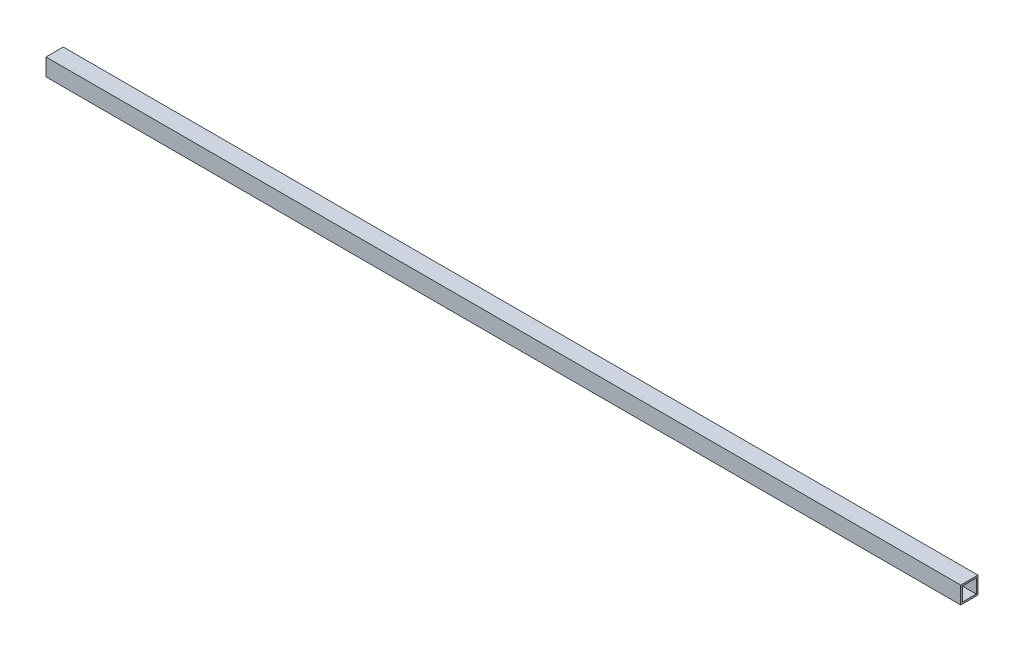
SolidWorks part; units mm, degrees
ref_plane "Plan de face" through (0, 0, 0) normal (0, 0, 1) x (1, 0, 0)
ref_plane "Plan de dessus" through (0, 0, 0) normal (0, 1, 0) x (1, 0, 0)
ref_plane "Plan de droite" through (0, 0, 0) normal (1, 0, 0) x (0, 0, -1)
sketch "Esquisse1" plane through (0, 0, 0) normal (1, 0, 0) x (0, 0, -1)
  line L1 (0, 0) -> (20, 0)
  line L2 (0, 0) -> (0, 20)
  line L3 (0, 20) -> (20, 20)
  line L4 (20, 0) -> (20, 20)
  line L5 (2, 2) -> (18, 2)
  line L6 (2, 2) -> (2, 18)
  line L7 (2, 18) -> (18, 18)
  line L8 (18, 2) -> (18, 18)
  dimension "D1" = 20
  dimension "D2" = 20
  dimension "D3" = 2
  dimension "D4" = 2
  dimension "D5" = 2
  dimension "D6" = 2
extrude "Boss.-Extru.1" add sketch "Esquisse1" along normal blind 1060
